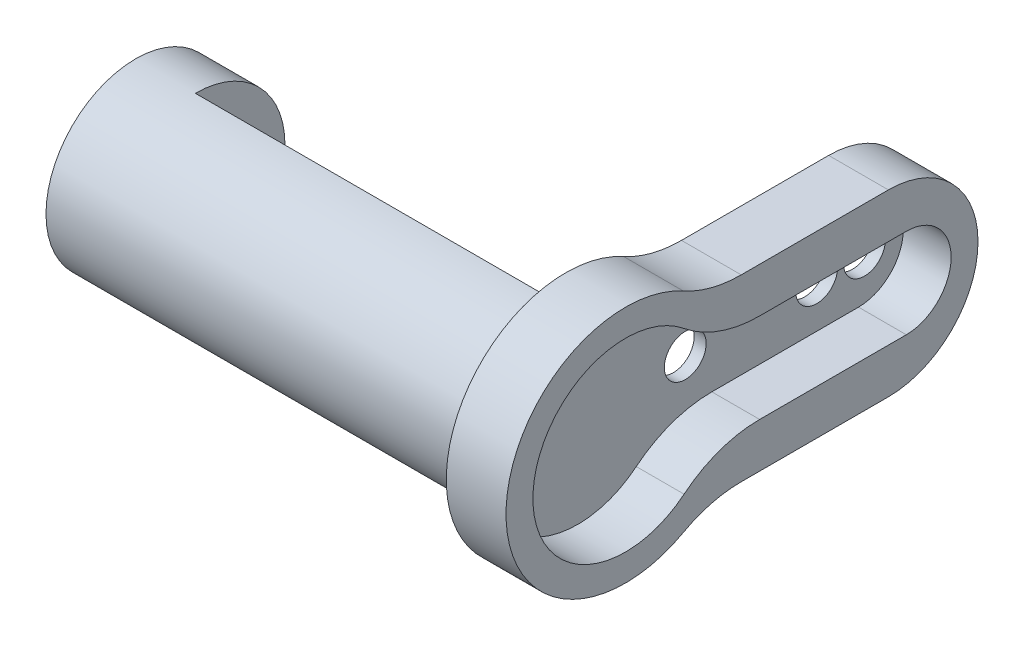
SolidWorks part; units mm, degrees
ref_plane "Front Plane" through (0, 0, 0) normal (0, 0, 1) x (1, 0, 0)
ref_plane "Top Plane" through (0, 0, 0) normal (0, 1, 0) x (1, 0, 0)
ref_plane "Right Plane" through (0, 0, 0) normal (1, 0, 0) x (0, 0, -1)
sketch "Sketch1" plane through (0, 0, 0) normal (1, 0, 0) x (0, 0, -1)
  circle A0 centre (0, 0) radius 7.5
  dimension "D1" = 15
extrude "Boss-Extrude1" add sketch "Sketch1" along normal mid plane 36
sketch "Sketch2" plane through (18, 0, 0) normal (1, 0, 0) x (0, 0, -1)
  line L0 (0, 0) -> (22, 0) construction
  line L1 (0, 7.5) -> (22, 7.5)
  line L2 (0, -7.5) -> (22, -7.5)
  arc A0 (22, -7.5) -> (22, 7.5) centre (22, 0) ccw
  circle A1 centre (0, 0) radius 7.5 construction
  circle A3 centre (0, 0) radius 7.5
  arc A4 (0, 7.5) -> (0, -7.5) centre (0, 0) ccw
  dimension "D2" = 15
  dimension "D1" = 22
  dimension "D3" = 0
extrude "Boss-Extrude2" add sketch "Sketch2" against normal blind 5
sketch "Sketch3" plane through (18, 0, 0) normal (1, 0, 0) x (0, 0, -1)
  circle A0 centre (0, 0) radius 10
  dimension "D1" = 20
extrude "Boss-Extrude3" add sketch "Sketch3" against normal up to surface (5 mm away)
fillet "Fillet1" radius 10 2 edges at (15.5, -7.5, -6.6144) (15.5, 7.5, -6.6144)
sketch "Sketch4" plane through (18, 0, 0) normal (1, 0, 0) x (0, 0, -1)
  line L0 (-7.75, 0) -> (27.25, 0) construction
  line L1 (23.5, 3.75) -> (11.225, 3.75)
  line L2 (23.5, -3.75) -> (11.225, -3.75)
  arc A0 (4.901, 6.0035) -> (4.901, -6.0035) centre (0, 0) ccw
  arc A1 (23.5, -3.75) -> (23.5, 3.75) centre (23.5, 0) ccw
  arc A2 (11.225, -3.75) -> (4.901, -6.0035) centre (11.225, -13.75) ccw
  arc A3 (11.225, 3.75) -> (4.901, 6.0035) centre (11.225, 13.75) cw
  dimension "D1" = 15.5
  dimension "D3" = 7.5
  dimension "D4" = 10
  dimension "D2" = 35
extrude "Cut-Extrude1" cut sketch "Sketch4" against normal blind 4
sketch "Sketch5" plane through (14, 0, 0) normal (1, 0, 0) x (0, 0, -1)
  line L0 (0, 0) -> (27.25, 0) construction
  arc A0 (23.5, -3.75) -> (23.5, 3.75) centre (23.5, 0) ccw construction
  circle A1 centre (24, 0) radius 1.75
  circle A2 centre (20, 0) radius 1.75
  circle A3 centre (9, 0) radius 1.75
  point P13 (0, 0)
  point P14 (24.0005, 0)
  point P15 (24.6985, 0)
  point P18 (22.651, 0)
  dimension "D1" = 3.5
  dimension "D2" = 4
  dimension "D3" = 3.5
  dimension "D4" = 3.5
  dimension "D5" = 11
  dimension "D6" = 0.5
extrude "Cut-Extrude2" cut sketch "Sketch5" against normal blind 24
sketch "Sketch6" plane through (-18, 0, 0) normal (-1, 0, 0) x (0, 0, 1)
  line L0 (0, 7.5) -> (0, -7.5)
  circle A0 centre (0, 0) radius 7.5 construction
  circle A1 centre (0, 0) radius 7.5 construction
  circle A3 centre (0, 0) radius 7.5
  arc A4 (0, 7.5) -> (0, -7.5) centre (0, 0) ccw
  dimension "D1" = 0
extrude "Cut-Extrude3" cut sketch "Sketch6" against normal up to surface (31 mm away)
sketch "Sketch7" plane through (-18, 0, 0) normal (-1, 0, 0) x (0, 0, 1)
  circle A0 centre (0, 0) radius 7.5
  arc A1 (0, -7.5) -> (0, 7.5) centre (0, 0) ccw construction
extrude "Boss-Extrude4" add sketch "Sketch7" along normal blind 5
